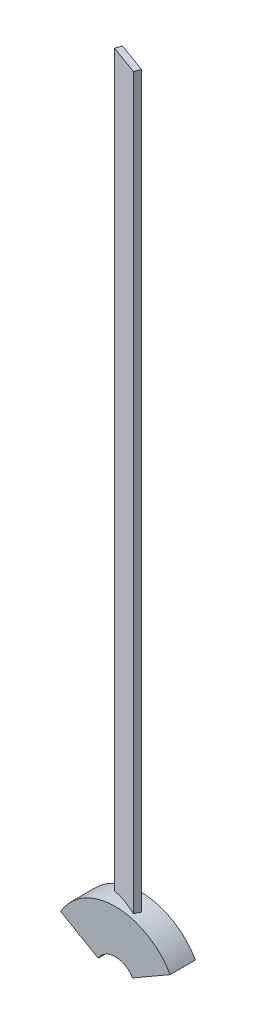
SolidWorks part; units mm, degrees
ref_plane "Front Plane" through (0, 0, 0) normal (0, 0, 1) x (1, 0, 0)
ref_plane "Top Plane" through (0, 0, 0) normal (0, 1, 0) x (1, 0, 0)
ref_plane "Right Plane" through (0, 0, 0) normal (1, 0, 0) x (0, 0, -1)
sketch "Sketch1" plane through (0, 0, 0) normal (0, 0, 1) x (1, 0, 0)
  circle A0 centre (0, 0) radius 400
  dimension "D1" = 800
extrude "Extrude1" add sketch "Sketch1" along normal mid plane 160
sketch "Sketch2" plane through (0, 0, 0) normal (0, 1, 0) x (1, 0, 0)
  line L0 (0, 0) -> (270.7256, 0) construction
  line L1 (0, 0) -> (0, 134.3833) construction
  line L2 (0, 0) -> (254.4154, -92.5996) construction
  line L3 (0, 0) -> (49.5925, 136.2542) construction
  line L4 (-100.8097, 15.4082) -> (87.1289, -52.9959)
  line L5 (87.1289, -52.9959) -> (100.8097, -15.4082)
  line L6 (100.8097, -15.4082) -> (-87.1289, 52.9959)
  line L7 (-87.1289, 52.9959) -> (-100.8097, 15.4082)
  dimension "D1" = 20
  dimension "D2" = 200
  dimension "D3" = 40
  dimension "D4" = 100
  dimension "D5" = 20
extrude "Extrude2" add sketch "Sketch2" along normal blind 5000
pattern_circular "CirPattern1" count 3 over 360 about axis through (0, 0, 0) along (0, 0, 1) of "Extrude2"
sketch "Sketch3" plane through (0, 0, 80) normal (0, 0, 1) x (1, 0, 0)
  circle A0 centre (0, 0) radius 125
  dimension "D1" = 250
extrude "Cut-Extrude1" cut sketch "Sketch3" against normal through all
sketch "Sketch4" plane through (0, 0, 80) normal (0, 0, 1) x (1, 0, 0)
  line L0 (0, 0) -> (649.5191, 375)
  line L1 (0, 0) -> (-649.5191, 375)
  line L2 (0, 0) -> (0, 1194.1302) construction
  circle A0 centre (0, 0) radius 750 construction
  dimension "D3" = 1500
  dimension "D1" = 120
  dimension "D2" = 60
extrude "Cut-Extrude2" cut sketch "Sketch4" against normal through all and the other way through all
equation "\"D4@Sketch2\" = \"D2@Sketch2\" / 2"
equation "\"D5@Sketch2\" = \"D3@Sketch2\" / 2"
